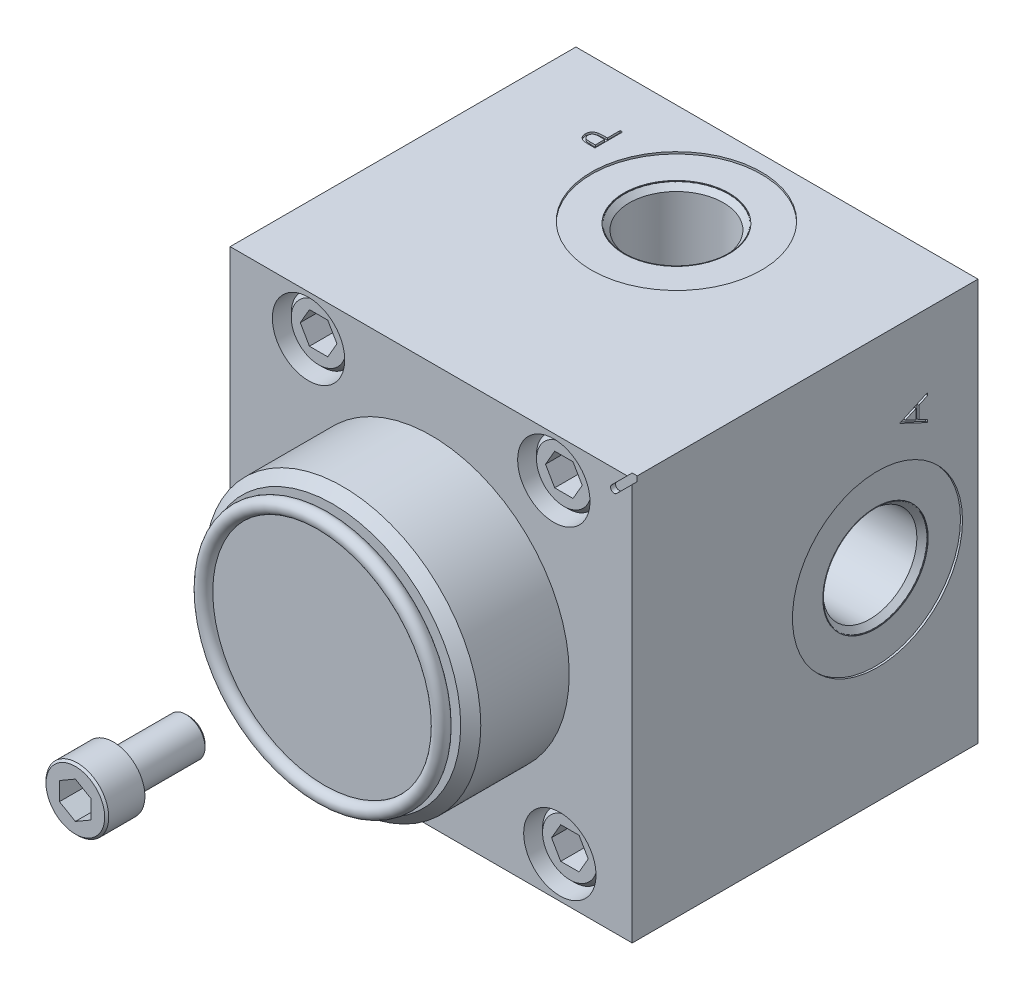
SolidWorks part; units mm, degrees
ref_plane "Front Plane" through (0, 0, 0) normal (0, 0, 1) x (1, 0, 0)
ref_plane "Top Plane" through (0, 0, 0) normal (0, 1, 0) x (1, 0, 0)
ref_plane "Right Plane" through (0, 0, 0) normal (1, 0, 0) x (0, 0, -1)
imported_body "Imported1"
imported_body "Surface-Imported1"
imported_body "Surface-Imported2"
imported_body "Surface-Imported3"
imported_body "Surface-Imported4"
imported_body "Surface-Imported5"
imported_body "Surface-Imported6"
imported_body "Surface-Imported7"
imported_body "Surface-Imported8"
imported_body "Surface-Imported9"
imported_body "Surface-Imported10"
imported_body "Surface-Imported11"
imported_body "Surface-Imported12"
imported_body "Imported2"
sketch "Sketch1" plane through (0, 0, 0) normal (1, 0, 0) x (0, 0, -1)
  line L0 (0, 0) -> (-43.688, 0) construction
  line L1 (0, 0) -> (0, 50.8) construction
  text T0 "<r90>A</r>"
  dimension "D1" = 38.1
  dimension "D2" = 6.35
extrude "Cut-Extrude1" cut sketch "Sketch1" against normal blind 0.254
sketch "Sketch2" plane through (0, 50.8, 0) normal (0, 1, 0) x (1, 0, 0)
  line L0 (0, -43.053) -> (0, 0) construction
  line L1 (0, 0) -> (-50.8, 0) construction
  text T0 "<r180>P</r>"
  dimension "D1" = 38.1
  dimension "D2" = 6.35
extrude "Cut-Extrude2" cut sketch "Sketch2" against normal blind 0.254
sketch "Sketch4" plane through (-50.8, 0, 0) normal (-1, 0, 0) x (0, 0, 1)
  line L0 (43.688, 50.8) -> (0, 50.8) construction
  line L1 (0, 50.8) -> (0, 0) construction
  text T0 "<r-90>B</r>"
  dimension "D1" = 38.1
  dimension "D2" = 6.35
extrude "Cut-Extrude3" cut sketch "Sketch4" against normal blind 0.254
sketch "Sketch5" plane through (0, 0, 0) normal (0, -1, 0) x (1, 0, 0)
  line L0 (-50.8, 43.688) -> (-50.8, 0) construction
  line L1 (-50.8, 0) -> (0, 0) construction
  text T0 "T"
  point P5 (-12.587, 12.6724)
  dimension "D1" = 38.1
  dimension "D2" = 6.35
extrude "Cut-Extrude4" cut sketch "Sketch5" against normal blind 0.254
